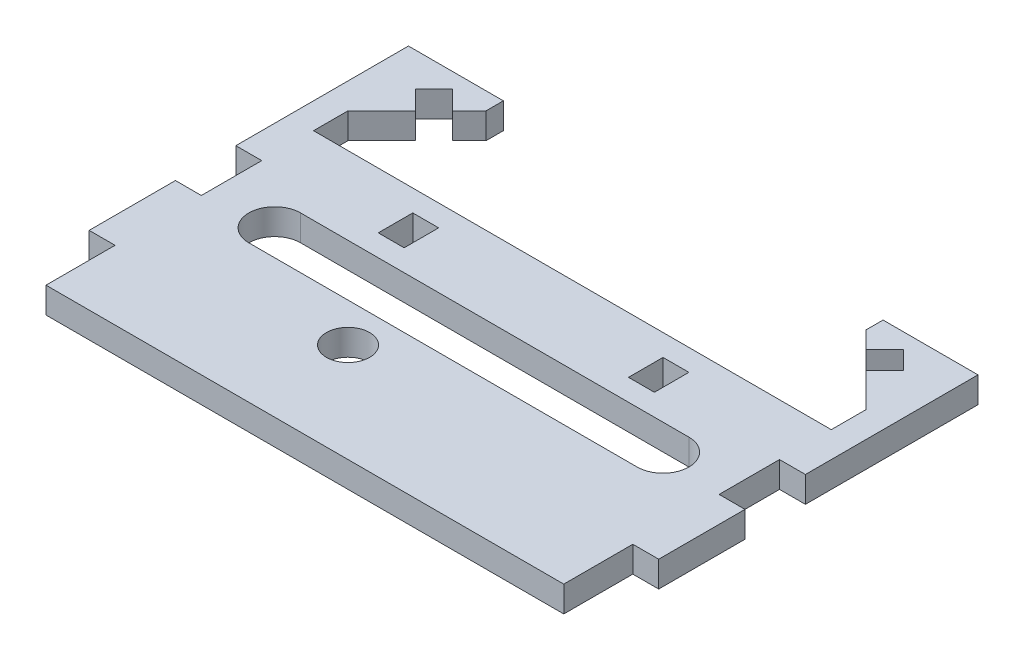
SolidWorks part; units mm, degrees
ref_plane "Front Plane" through (0, 0, 0) normal (0, 0, 1) x (1, 0, 0)
ref_plane "Top Plane" through (0, 0, 0) normal (0, 1, 0) x (1, 0, 0)
ref_plane "Right Plane" through (0, 0, 0) normal (1, 0, 0) x (0, 0, -1)
sketch "Sketch1" plane through (0, 0, 0) normal (0, 1, 0) x (1, 0, 0)
  line L1 (-30, 18) -> (30, 18)
  line L2 (-30, 18) -> (-30, -18)
  line L3 (-30, -18) -> (30, -18)
  line L4 (30, 18) -> (30, -18)
  line L5 (-30, 18) -> (30, -18) construction
  line L6 (-30, -18) -> (30, 18) construction
  point P0 (0, 0)
  dimension "D1" = 60
  dimension "D2" = 36
extrude "Boss-Extrude1" add sketch "Sketch1" along normal blind 3
sketch "Sketch2" plane through (0, 0, 0) normal (0, 1, 0) x (1, 0, 0)
  line L0 (0, 0) -> (0, -6.5) construction
  line L1 (0, -6.5) -> (-6.5, -6.5) construction
  circle A0 centre (0, -6.5) radius 2.5 construction
  circle A1 centre (-6.5, -6.5) radius 2.5
  dimension "D1" = 5
  dimension "D2" = 6.5
  dimension "D3" = 6.5
extrude "Cut-Extrude1" cut sketch "Sketch2" along normal blind 3
sketch "Sketch3" plane through (0, 0, 0) normal (0, 1, 0) x (1, 0, 0)
  line L0 (-30, -5) -> (-31.5, -5) construction
  line L1 (-30, 18) -> (-30, -18) construction
  line L2 (0, 0) -> (0, 6.3123) construction
  line L3 (33, -10) -> (30, 0) construction
  line L4 (-33, 0) -> (-30, 0)
  line L5 (-33, 0) -> (-33, -10)
  line L6 (-33, -10) -> (-30, -10)
  line L7 (-30, 0) -> (-30, -10)
  line L8 (-33, 0) -> (-30, -10) construction
  line L9 (-33, -10) -> (-30, 0) construction
  line L10 (33, 0) -> (30, -10) construction
  line L11 (30, -5) -> (31.5, -5) construction
  line L12 (30, 0) -> (30, -10)
  line L13 (33, -10) -> (30, -10)
  line L14 (33, 0) -> (33, -10)
  line L15 (33, 0) -> (30, 0)
  dimension "D1" = 3
  dimension "D2" = 10
  dimension "D3" = 5
extrude "Boss-Extrude2" add sketch "Sketch3" along normal blind 3
sketch "Sketch4" plane through (0, 0, 0) normal (0, 1, 0) x (1, 0, 0)
  line L1 (-30, 18) -> (30, 18)
  line L2 (-30, 18) -> (-30, 13)
  line L3 (-30, 13) -> (30, 13)
  line L4 (30, 18) -> (30, 13)
  dimension "D1" = 5
extrude "Cut-Extrude2" cut sketch "Sketch4" along normal blind 3
sketch "Sketch5" plane through (0, 0, 0) normal (0, 1, 0) x (1, 0, 0)
  line L0 (-33, 7) -> (-33, 27)
  line L1 (-33, 27) -> (-22, 27)
  line L2 (-22, 27) -> (-22, 25)
  line L3 (-22, 25) -> (-30, 17)
  line L4 (-30, 17) -> (-30, 13)
  line L5 (-30, 13) -> (30, 13) construction
  line L6 (0, 0) -> (0, 13) construction
  line L7 (30, 7) -> (30, 13)
  line L8 (33, 7) -> (30, 7)
  line L9 (30, 17) -> (30, 13)
  line L10 (22, 25) -> (30, 17)
  line L11 (22, 27) -> (22, 25)
  line L12 (33, 27) -> (22, 27)
  line L13 (33, 7) -> (33, 27)
  line L14 (-33, 7) -> (-30, 7)
  line L15 (-30, 7) -> (-30, 13)
  dimension "D1" = 45
  dimension "D2" = 11
  dimension "D3" = 4
  dimension "D4" = 2
  dimension "D5" = 3
  dimension "D6" = 6
extrude "Boss-Extrude3" add sketch "Sketch5" along normal blind 3
sketch "Sketch6" plane through (0, 0, 0) normal (0, 1, 0) x (1, 0, 0)
  line L0 (-25.0205, 21.9795) -> (-26.1165, 23.0756) construction
  line L1 (-30, 17) -> (-22, 25) construction
  line L2 (-28.2731, 23.1109) -> (-26.0811, 20.9189)
  line L3 (-28.2731, 23.1109) -> (-26.1518, 25.2322)
  line L4 (-26.0811, 20.9189) -> (-23.9598, 23.0402)
  line L5 (-26.1518, 25.2322) -> (-23.9598, 23.0402)
  line L6 (-28.2731, 23.1109) -> (-23.9598, 23.0402) construction
  line L7 (-26.0811, 20.9189) -> (-26.1518, 25.2322) construction
  line L8 (0, 0) -> (0, 6.2736) construction
  line L9 (26.0811, 20.9189) -> (26.1518, 25.2322) construction
  line L10 (28.2731, 23.1109) -> (23.9598, 23.0402) construction
  line L11 (25.0205, 21.9795) -> (26.1165, 23.0756) construction
  line L12 (26.1518, 25.2322) -> (23.9598, 23.0402)
  line L13 (26.0811, 20.9189) -> (23.9598, 23.0402)
  line L14 (28.2731, 23.1109) -> (26.1518, 25.2322)
  line L15 (28.2731, 23.1109) -> (26.0811, 20.9189)
  line L16 (-22, 27) -> (-20, 27) construction
  line L17 (-20, 27) -> (-22, 25) construction
  line L18 (-30, 17) -> (-22, 25) construction
  dimension "D1" = 3
  dimension "D2" = 3.1
  dimension "D3" = 5.6
extrude "Cut-Extrude3" cut sketch "Sketch6" along normal blind 3
sketch "Sketch7" plane through (0, 0, 0) normal (0, 1, 0) x (1, 0, 0)
  line L0 (0, 0) -> (0, 1) construction
  line L1 (-22.5, 1) -> (22.5, 1) construction
  line L2 (-22.5, 1) -> (22.5, 1) construction
  line L3 (-22.5, 4) -> (22.5, 4)
  line L4 (-22.5, -2) -> (22.5, -2)
  line L10 (-30, 13) -> (30, 13) construction
  line L11 (0, 1) -> (0, 8.5) construction
  line L12 (-14.5, 8.5) -> (14.5, 8.5) construction
  line L14 (13, 10.5) -> (16, 10.5)
  line L15 (13, 10.5) -> (13, 6.5)
  line L16 (13, 6.5) -> (16, 6.5)
  line L17 (16, 10.5) -> (16, 6.5)
  line L18 (13, 10.5) -> (16, 6.5) construction
  line L19 (13, 6.5) -> (16, 10.5) construction
  line L20 (-16, 10.5) -> (-13, 10.5)
  line L21 (-16, 10.5) -> (-16, 6.5)
  line L22 (-16, 6.5) -> (-13, 6.5)
  line L23 (-13, 10.5) -> (-13, 6.5)
  line L24 (-16, 10.5) -> (-13, 6.5) construction
  line L25 (-16, 6.5) -> (-13, 10.5) construction
  arc A0 (-22.5, 4) -> (-22.5, -2) centre (-22.5, 1) ccw
  arc A1 (22.5, -2) -> (22.5, 4) centre (22.5, 1) ccw
  point P5 (0, 1)
  point P6 (0, 1)
  point P16 (0, 8.5)
  dimension "D1" = 6
  dimension "D2" = 45
  dimension "D3" = 9
  dimension "D4" = 3
  dimension "D5" = 4
  dimension "D6" = 2.5
  dimension "D7" = 32
extrude "Cut-Extrude4" cut sketch "Sketch7" along normal up to next
